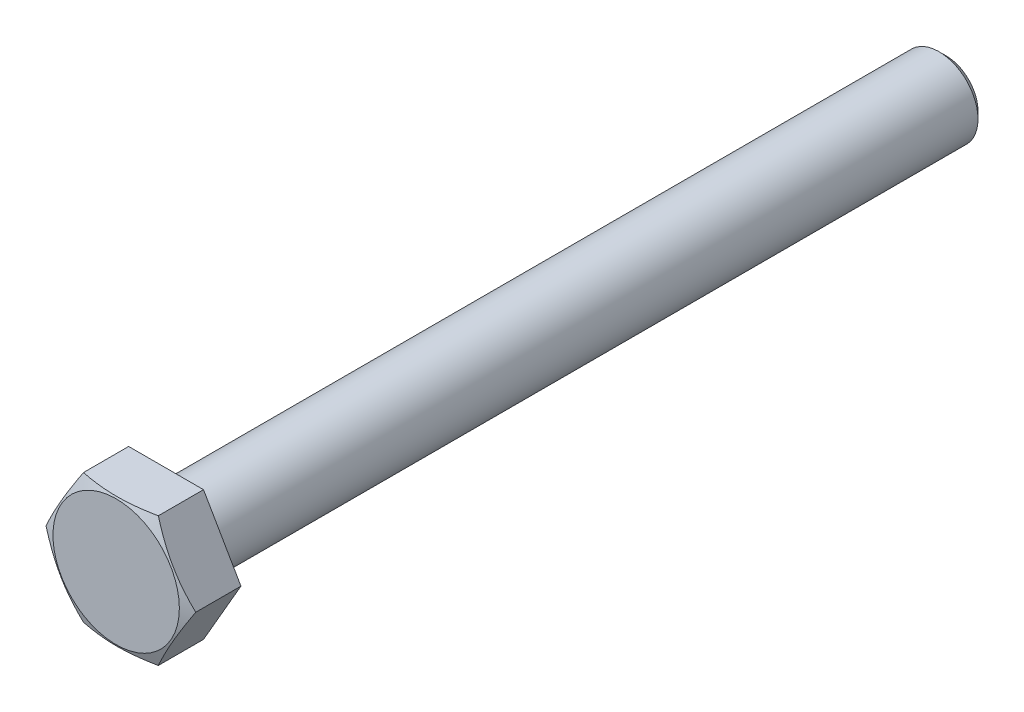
SolidWorks part; units mm, degrees
ref_plane "Plan1" through (0, 0, 0) normal (0, 0, 1) x (1, 0, 0)
ref_plane "Plan2" through (0, 0, 0) normal (0, 1, 0) x (1, 0, 0)
ref_plane "Plan3" through (0, 0, 0) normal (1, 0, 0) x (0, 0, -1)
imported_body "Vis à métaux - Tête hexagonale - Tige normale DIN 931 - M6x60 - 5,6"
sketch "Esquisse1" plane through (0, 0, -42) normal (0, 0, 1) x (1, 0, 0)
  circle A0 centre (0, 0) radius 3 construction
  circle A1 centre (0, 0) radius 3
extrude "Boss.-Extru.1" add sketch "Esquisse1" along normal up to next
